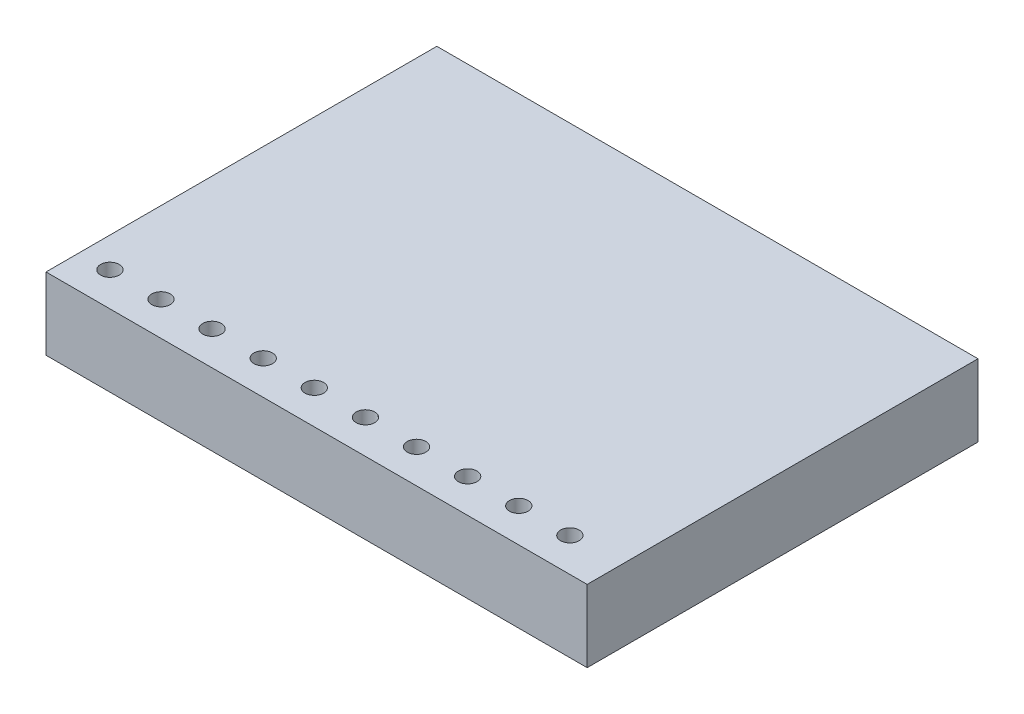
SolidWorks part; units mm, degrees
ref_plane "Y" through (0, 0, 0) normal (0, 0, 1) x (1, 0, 0)
ref_plane "Z" through (0, 0, 0) normal (0, 1, 0) x (1, 0, 0)
ref_plane "X" through (0, 0, 0) normal (1, 0, 0) x (0, 0, -1)
sketch "Skizze1" plane through (0, 0, 0) normal (0, 1, 0) x (1, 0, 0)
  line L0 (0, 0) -> (0, 19.9909) construction
  line L1 (-45, 32.5) -> (45, 32.5)
  line L2 (-45, 32.5) -> (-45, -32.5)
  line L3 (-45, -32.5) -> (45, -32.5)
  line L4 (45, 32.5) -> (45, -32.5)
  line L5 (0, 0) -> (20.4549, 0) construction
  dimension "D1" = 90
  dimension "D2" = 65
extrude "Platte" add sketch "Skizze1" along normal blind 12
sketch "Skizze2" plane through (0, 12, 0) normal (0, 1, 0) x (-1, 0, 0)
  line L0 (45, -32.5) -> (45, 32.5) construction
  circle A0 centre (40, 26.8754) radius 1.5468
  dimension "D1" = 5
extrude "Schnitt-Linear austragen1" cut sketch "Skizze2" against normal through all
pattern_linear "Lineares Muster1" count 10 spacing 8.5 along (1, 0, 0) of "Schnitt-Linear austragen1"
equation "\"D3@Lineares Muster1\" =( \"D1@Skizze1\"-\"D1@Skizze2\" )/ \"D1@Lineares Muster1\""
